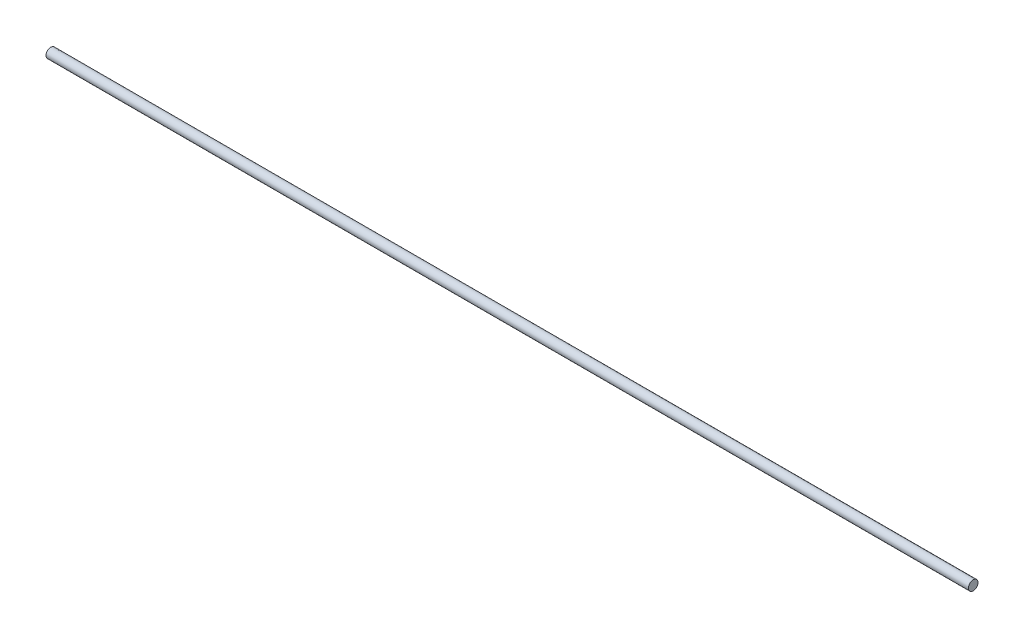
SolidWorks part; units mm, degrees
ref_plane "Ebene vorne" through (0, 0, 0) normal (0, 0, 1) x (1, 0, 0)
ref_plane "Ebene oben" through (0, 0, 0) normal (0, 1, 0) x (1, 0, 0)
ref_plane "Ebene rechts" through (0, 0, 0) normal (1, 0, 0) x (0, 0, -1)
sketch "Skizze1" plane through (0, 0, 0) normal (1, 0, 0) x (0, 0, -1)
  circle A0 centre (0, 0) radius 4
  dimension "D1" = 8
extrude "Aufsatz-Linear austragen1" add sketch "Skizze1" along normal mid plane 770
